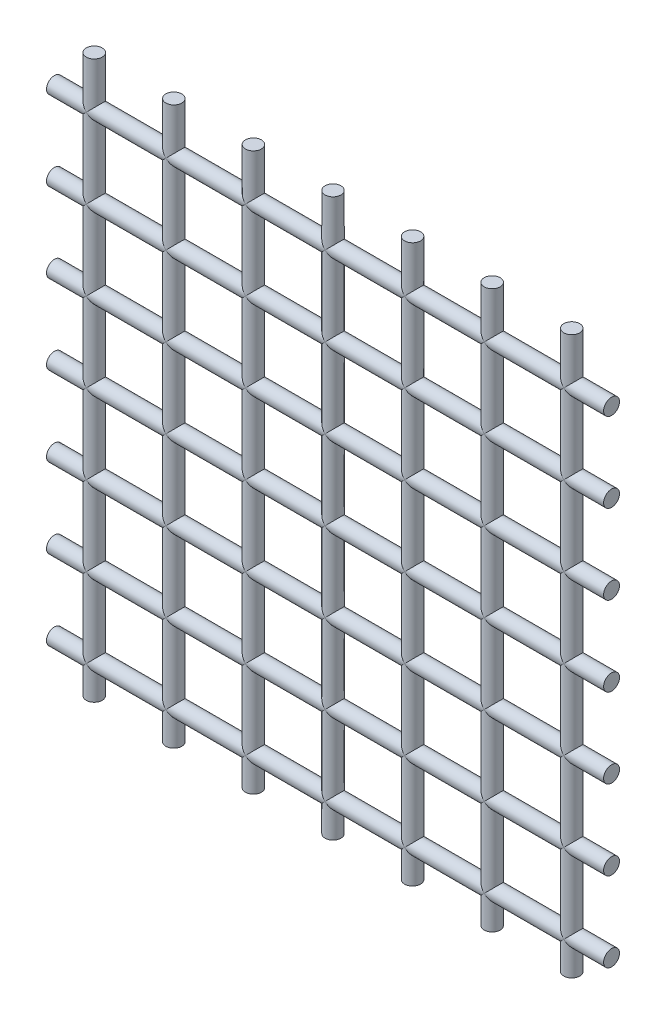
SolidWorks part; units mm, degrees
ref_plane "Front" through (0, 0, 0) normal (0, 0, 1) x (1, 0, 0)
ref_plane "Top" through (0, 0, 0) normal (0, 1, 0) x (1, 0, 0)
ref_plane "Right" through (0, 0, 0) normal (1, 0, 0) x (0, 0, -1)
sketch "Sketch1" plane through (0, 0, 0) normal (0, 0, 1) x (1, 0, 0)
  line L0 (-17.5, 0) -> (17.5, 0)
  line L1 (0, 36.2747) -> (0, -17.9188) construction
  dimension "D1" = 35
ref_plane "Plane4" through (-17.5, 0, 0) normal (1, 0, 0) x (0, 0, -1)
sketch "Sketch2" plane through (-17.5, 0, 0) normal (1, 0, 0) x (0, 0, -1)
  circle A0 centre (0, 0) radius 0.5
  dimension "D1" = 1
sweep "Base-Sweep" add profiles "Sketch2" path "Sketch1"
sketch "Sketch3" plane through (0, 0, 0) normal (0, 0, 1) x (1, 0, 0)
  line L0 (39.0535, 0) -> (-37.7558, 0) construction
  line L1 (17.5, 0) -> (-17.5, 0) construction
  line L2 (-15, 3) -> (-15, -32)
  dimension "D1" = 15
  dimension "D2" = 3
  dimension "D3" = 35
ref_plane "Plane5" through (-15, 3, 0) normal (0, -1, 0) x (1, 0, 0)
sketch "Sketch4" plane through (-15, 3, 0) normal (0, -1, 0) x (1, 0, 0)
  circle A0 centre (0, 0) radius 0.5
  dimension "D1" = 1
sweep "Boss-Sweep1" add profiles "Sketch4" path "Sketch3"
pattern_linear "LPattern2" count 7 spacing 5 along (1, 0, 0)
pattern_linear "LPattern3" count 7 spacing 5 along (0, -1, 0)
scale "Scale1"
